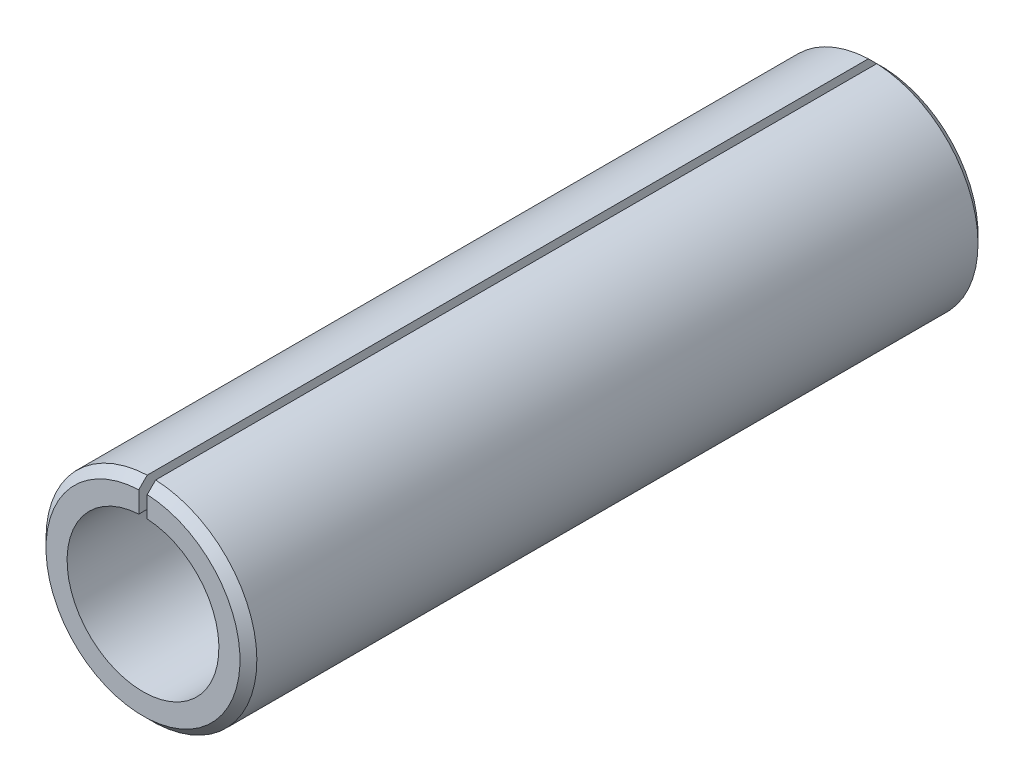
SolidWorks part; units mm, degrees
ref_plane "Front Plane" through (0, 0, 0) normal (0, 0, 1) x (1, 0, 0)
ref_plane "Top Plane" through (0, 0, 0) normal (0, 1, 0) x (1, 0, 0)
ref_plane "Right Plane" through (0, 0, 0) normal (1, 0, 0) x (0, 0, -1)
sketch "Sketch1" plane through (0, 0, 0) normal (0, 0, 1) x (1, 0, 0)
  line L0 (0, 0) -> (0, 2.7193) construction
  line L1 (-0.0635, 1.1412) -> (-0.0635, 1.5862)
  line L2 (0.0635, 1.1412) -> (0.0635, 1.5862)
  arc A0 (-0.0635, 1.5862) -> (0.0635, 1.5862) centre (0, 0) ccw
  arc A1 (-0.0635, 1.1412) -> (0.0635, 1.1412) centre (0, 0) ccw
  circle A2 centre (0, 0) radius 0.0635 construction
  dimension "D1" = 2.286
  dimension "D2" = 3.175
  dimension "D3" = 0.127
extrude "Boss-Extrude1" add sketch "Sketch1" along normal mid plane 11.1125
chamfer "Chamfer1" distance 0.127 angle 45 2 edges at (0, -1.5875, -5.5562) (0, -1.5875, 5.5562)
